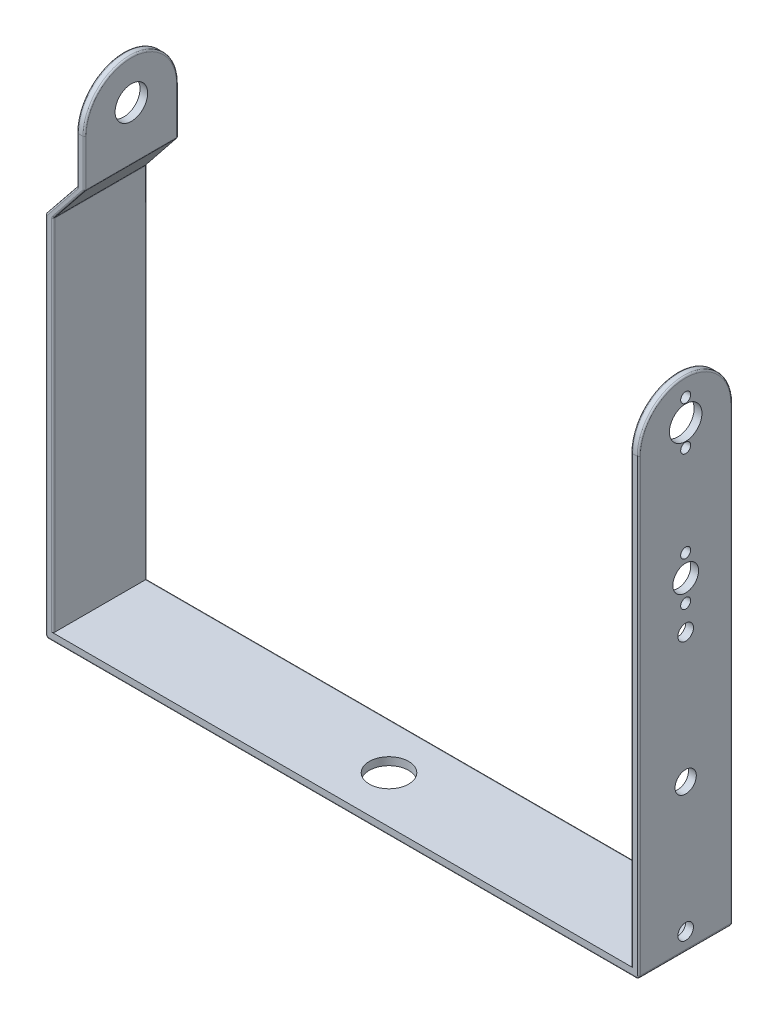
SolidWorks part; units mm, degrees
ref_plane "Plan de face" through (0, 0, 0) normal (0, 0, 1) x (1, 0, 0)
ref_plane "Plan de dessus" through (0, 0, 0) normal (0, 1, 0) x (1, 0, 0)
ref_plane "Plan de droite" through (0, 0, 0) normal (1, 0, 0) x (0, 0, -1)
inserted part "support"
other "<support>-<Enlèv. mat.-Extru.6>"
sketch "Esquisse1" plane through (-2.5, 0, 0) normal (-1, 0, 0) x (0, 0, 1)
  line L0 (15, 2.5) -> (15, 89) construction
  line L3 (29.5, 2.5) -> (0.5, 2.5) construction
  circle A0 centre (15, 89) radius 2.5
  circle A1 centre (15, 6) radius 2.5
  dimension "D1" = 83
  dimension "D3" = 5
  dimension "D4" = 5
  dimension "D2" = 3.5
extrude "Enlèv. mat.-Extru.1" cut sketch "Esquisse1" against normal through all
sketch "Esquisse2" plane through (0, 0, 0) normal (1, 0, 0) x (0, 0, -1)
  line L0 (-15, 6) -> (-15, 89) construction
  circle A0 centre (-15, 47.5) radius 3.4
  dimension "D1" = 6.8
extrude "Enlèv. mat.-Extru.2" cut sketch "Esquisse2" against normal blind 10
sketch "Esquisse3" plane through (0, 0, 0) normal (1, 0, 0) x (0, 0, -1)
  line L0 (-15, 104) -> (-15, 89) construction
  line L1 (-15, 104) -> (-29.5, 104) construction
  line L2 (-29.5, 145) -> (-29.5, 1) construction
  circle A2 centre (-15, 104) radius 4.125
  dimension "D1" = 8.25
  dimension "D2" = 15
extrude "Enlèv. mat.-Extru.3" cut sketch "Esquisse3" against normal blind 10
sketch "Esquisse4" plane through (0, 0, 0) normal (1, 0, 0) x (0, 0, -1)
  line L0 (-15, 104) -> (-15, 111) construction
  line L1 (-15, 104) -> (-15, 97) construction
  line L2 (-15, 104) -> (-0.5, 104) construction
  line L3 (-0.5, 1) -> (-0.5, 145) construction
  line L4 (-15, 104) -> (-29.5, 104) construction
  line L5 (-29.5, 145) -> (-29.5, 1) construction
  circle A0 centre (-15, 111) radius 1.6
  circle A1 centre (-15, 97) radius 1.6
  dimension "D3" = 3.2
  dimension "D4" = 3.2
  dimension "D1" = 7
  dimension "D2" = 7
extrude "Enlèv. mat.-Extru.4" cut sketch "Esquisse4" against normal blind 10
